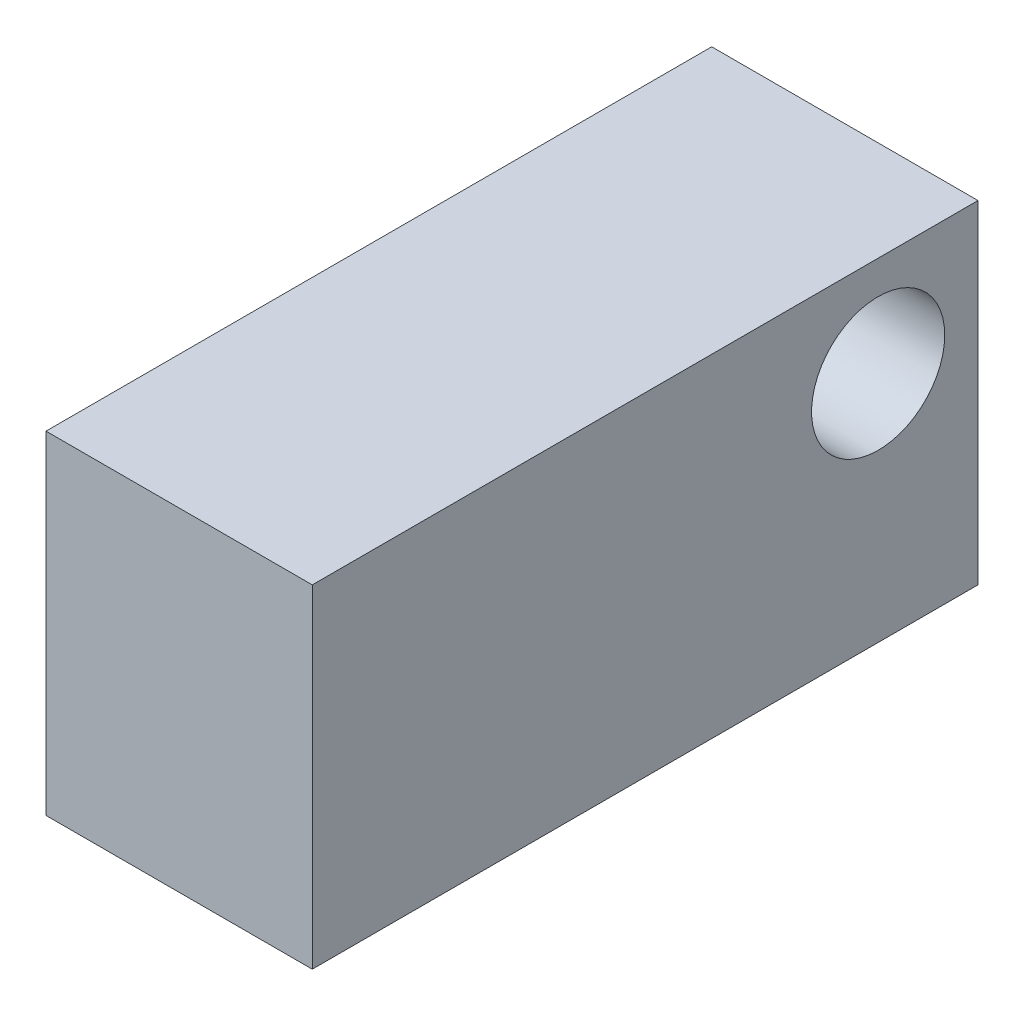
SolidWorks part; units mm, degrees
ref_plane "Ebene vorne" through (0, 0, 0) normal (0, 0, 1) x (1, 0, 0)
ref_plane "Ebene oben" through (0, 0, 0) normal (0, 1, 0) x (1, 0, 0)
ref_plane "Ebene rechts" through (0, 0, 0) normal (1, 0, 0) x (0, 0, -1)
sketch "Skizze1" plane through (0, 0, 0) normal (1, 0, 0) x (0, 0, -1)
  line L0 (-120, -150) -> (-20, -150)
  line L1 (-120, -150) -> (-120, -100)
  line L2 (-20, -150) -> (-20, -100)
  line L3 (-120, -100) -> (-20, -100)
  line L4 (156.3271, 0) -> (-156.3271, 0) construction
  line L6 (0, 133.5062) -> (0, -133.5062) construction
  dimension "D1" = 100
  dimension "D2" = 100
  dimension "D3" = 50
  dimension "D4" = 20
extrude "Aufsatz-Linear austragen1" add sketch "Skizze1" against normal blind 40
sketch "Skizze2" plane through (0, 0, 0) normal (1, 0, 0) x (0, 0, -1)
  line L0 (-20, -100) -> (-120, -100) construction
  line L1 (-20, -150) -> (-20, -100) construction
  circle A0 centre (-35, -115) radius 10
  dimension "D1" = 20
  dimension "D2" = 15
  dimension "D3" = 15
extrude "Schnitt-Linear austragen1" cut sketch "Skizze2" against normal blind 40
equation "\"Breite\"=25"
equation "\"Wandstärke\"=2"
